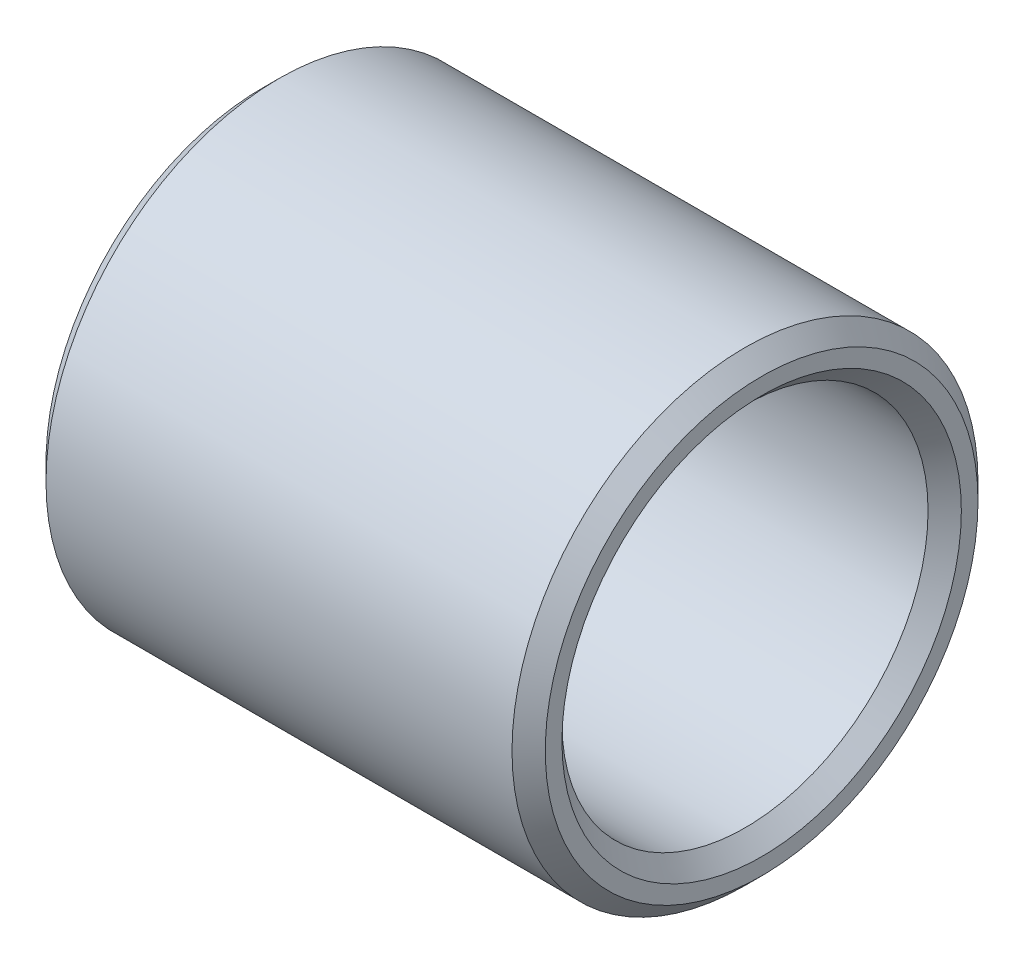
SolidWorks part; units mm, degrees
ref_plane "Plan de face" through (0, 0, 0) normal (0, 0, 1) x (1, 0, 0)
ref_plane "Plan de dessus" through (0, 0, 0) normal (0, 1, 0) x (1, 0, 0)
ref_plane "Plan de droite" through (0, 0, 0) normal (1, 0, 0) x (0, 0, -1)
sketch "Esquisse1" plane through (0, 0, 0) normal (0, 0, 1) x (1, 0, 0)
  line L0 (0, 12) -> (1, 11)
  line L1 (1, 11) -> (29, 11)
  line L2 (29, 11) -> (30, 12)
  line L3 (30, 12) -> (30, 13)
  line L4 (30, 13) -> (29, 14)
  line L5 (29, 14) -> (1, 14)
  line L6 (1, 14) -> (0, 13)
  line L7 (0, 13) -> (0, 12)
  line L8 (30, 0) -> (0, 0) construction
revolve "Révolution1" add sketch "Esquisse1" angle 360 about L8
ref_plane "Plan1" through (-5, 0, 0) normal (1, 0, 0) x (0, 0, -1)
